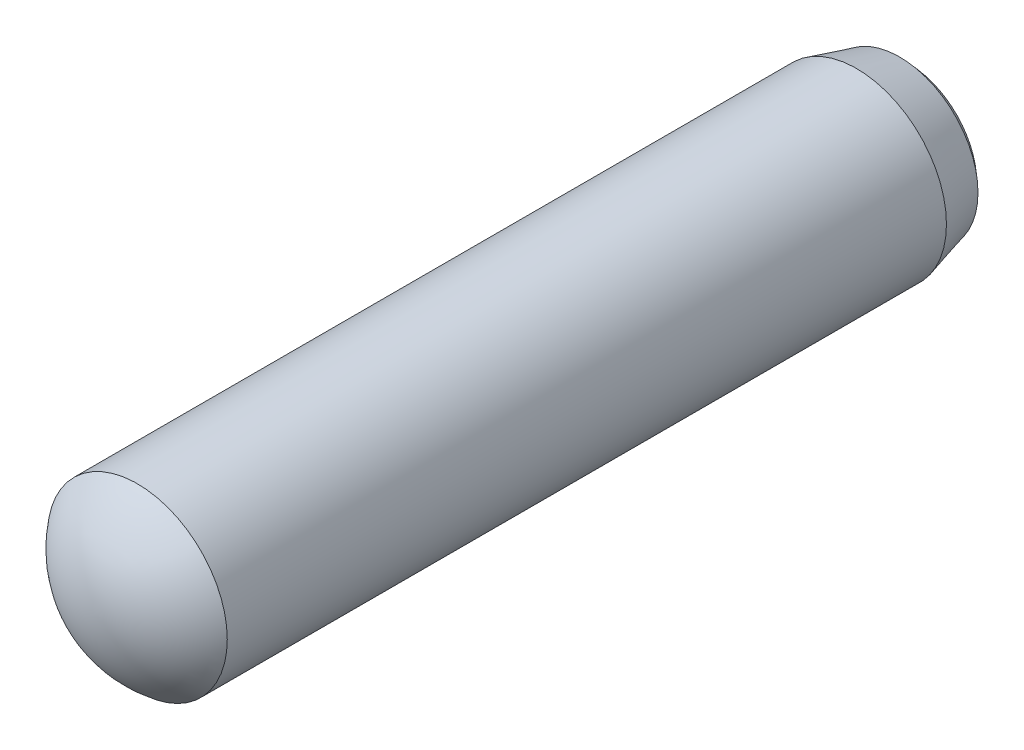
SolidWorks part; units mm, degrees
ref_plane "FACE" through (0, 0, 0) normal (0, 0, 1) x (1, 0, 0)
ref_plane "DESSUS" through (0, 0, 0) normal (0, 1, 0) x (1, 0, 0)
ref_plane "GAUCHE" through (0, 0, 0) normal (1, 0, 0) x (0, 0, -1)
sketch "Esquisse1" plane through (0, 0, 0) normal (0, 0, 1) x (1, 0, 0)
  circle A0 centre (0, 0) radius 1.5
  dimension "D1" = 3
extrude "Base-Extrusion" add sketch "Esquisse1" along normal blind 12.5
dome "Dôme1" faces to dome 1 distance 0.75 parameters "D1"=0.75
dome "Dôme2" faces to dome 1 distance 0.75 parameters "D1"=0.75
sketch "Esquisse2" plane through (0, 0, 0) normal (1, 0, 0) x (0, 0, -1)
  line L0 (0, 0) -> (1, 0) construction
  line L2 (0, 1.5) -> (-12.5, 1.5) construction
  line L3 (0, 1.5) -> (-0.5, 1.5)
  line L5 (0.2191, 1.3073) -> (-0.5, 1.5)
  arc A0 (0, -1.5) -> (0, 1.5) centre (-1.125, 0) ccw construction
  arc A1 (0.2191, 1.3073) -> (0, 1.5) centre (-1.125, 0) ccw
revolve "EnlMat-Révolution1" cut sketch "Esquisse2" angle 360 about L0
